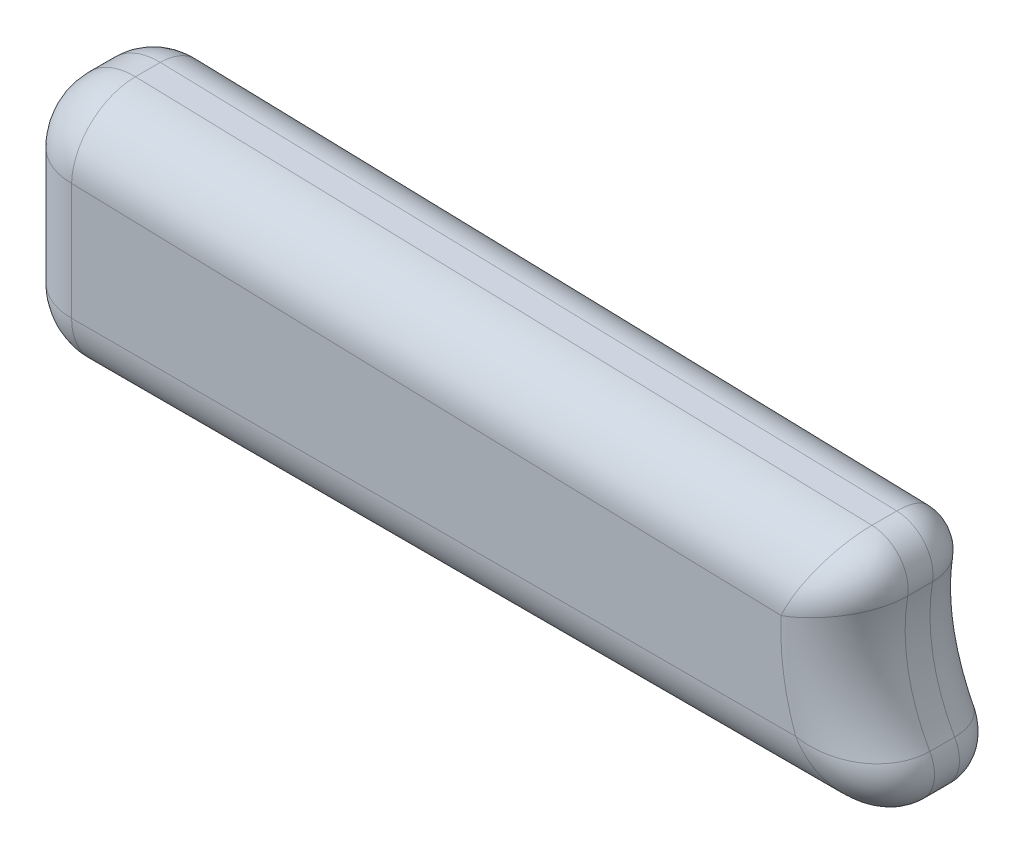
SolidWorks part; units mm, degrees
ref_plane "Face" through (0, 0, 0) normal (0, 0, 1) x (1, 0, 0)
ref_plane "Dessus" through (0, 0, 0) normal (0, 1, 0) x (1, 0, 0)
ref_plane "Droite" through (0, 0, 0) normal (1, 0, 0) x (0, 0, -1)
sketch "Esquisse2" plane through (0, 0, 0) normal (0, 0, 1) x (1, 0, 0)
  line L0 (873.2873, 124.6867) -> (280.8471, 140.9459)
  line L2 (229.4754, 90.9648) -> (229.4754, -2.9959)
  line L3 (279.4754, -52.9959) -> (894.6947, -52.9959)
  arc A0 (902.0532, 89.7483) -> (919.8531, -9.5817) centre (1049.9975, 65) ccw
  arc A1 (229.4754, 90.9648) -> (280.8471, 140.9459) centre (279.4754, 90.9648) cw
  arc A2 (279.4754, -52.9959) -> (229.4754, -2.9959) centre (279.4754, -2.9959) cw
  arc A3 (902.0532, 89.7483) -> (873.2873, 124.6867) centre (872.4643, 94.698) ccw
  arc A4 (894.6947, -52.9959) -> (919.8531, -9.5817) centre (894.6947, -23.9992) ccw
  dimension "D1" = 50
  dimension "D2" = 30
  dimension "D3" = 50
  dimension "D4" = 150
extrude "Base-Extrusion" add sketch "Esquisse2" along normal mid plane 110
fillet "Congé4" radius 50 8 edges at (244.1201, -38.3512, 55) (587.085, -52.9959, 55) (919.7832, -38.5379, 55) (902.3494, 38.5415, 55) (895.6245, 113.7664, 55) (577.0672, 132.8163, 55) (244.6084, 126.8018, 55) (229.4754, 43.9844, 55)
fillet "Congé5" radius 40 8 edges at (229.4754, 43.9844, -55) (244.6084, 126.8018, -55) (577.0672, 132.8163, -55) (895.6245, 113.7664, -55) (902.3494, 38.5415, -55) (919.7832, -38.5379, -55) (587.085, -52.9959, -55) (244.1201, -38.3512, -55)
